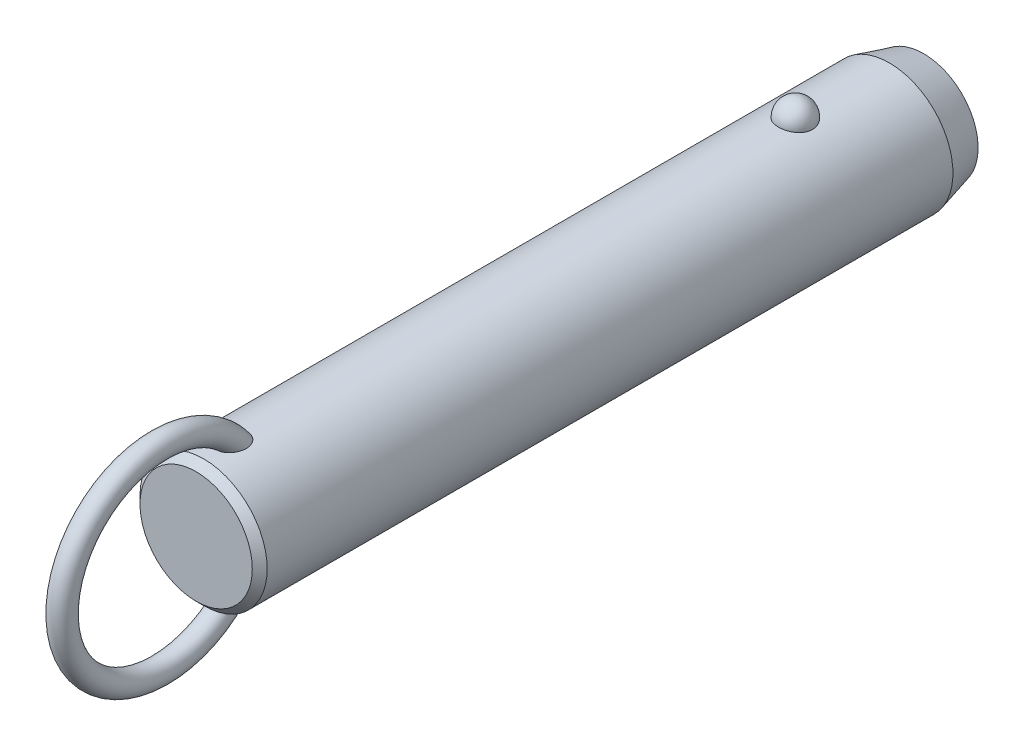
SolidWorks part; units mm, degrees
ref_plane "Front Plane" through (0, 0, 0) normal (0, 0, 1) x (1, 0, 0)
ref_plane "Top Plane" through (0, 0, 0) normal (0, 1, 0) x (1, 0, 0)
ref_plane "Right Plane" through (0, 0, 0) normal (1, 0, 0) x (0, 0, -1)
sketch "Sketch2" plane through (0, 0, 0) normal (0, 0, 1) x (1, 0, 0)
  circle A0 centre (0, 0) radius 11.1
  point P3 (0, 11.1)
  dimension "D1" = 22.2
extrude "Boss-Extrude1" add sketch "Sketch2" along normal blind 88.9
sketch "Sketch3" plane through (0, 0, 0) normal (0, 0, -1) x (-1, 0, 0)
  circle A0 centre (0, 0) radius 11.1
  dimension "D1" = 22.2
extrude "Boss-Extrude2" add sketch "Sketch3" along normal blind 25.4
chamfer "Chamfer1" distance 6 angle 15 1 edges at (-11.1, 0, -25.4)
sketch "Sketch12" plane through (0, 0, 0) normal (1, 0, 0) x (0, 0, -1)
  line L0 (-88.9, 11.1) -> (-88.9, -11.1) construction
  point P0 (-88.9, 0)
sketch "Sketch13" plane through (0, 0, 0) normal (1, 0, 0) x (0, 0, -1)
  circle A0 centre (-107.95, 0) radius 19.05
  point P2 (-88.9, 0)
  dimension "D1" = 38.1
sketch "Sketch14" plane through (0, 0, 0) normal (0, 1, 0) x (1, 0, 0)
  circle A0 centre (0, -90.9) radius 2
  point P2 (0, -88.9)
  dimension "D1" = 4
sweep "Sweep1" add profiles "Sketch14" path "Sketch13"
sketch "Sketch15" plane through (0, 0, 88.9) normal (0, 0, 1) x (1, 0, 0)
  circle A0 centre (0, 0) radius 11.1
  dimension "D1" = 22.2
extrude "Boss-Extrude3" add sketch "Sketch15" along normal blind 12.7
chamfer "Chamfer2" distance 1.3 angle 45 1 edges at (11.1, 0, 101.6)
sketch "Sketch18" plane through (0, 0, 0) normal (1, 0, 0) x (0, 0, -1)
  line L0 (19.4, 11.1) -> (-92.468, 11.1) construction
  line L1 (3, 14.1) -> (3, 8.1)
  line L2 (-92.468, -11.1) -> (19.4, -11.1) construction
  arc A0 (3, 14.1) -> (3, 8.1) centre (3, 11.1) ccw
  point P4 (0, 11.1)
  dimension "D1" = 25.2
revolve "Revolve1" add sketch "Sketch18" angle 360 about L1
